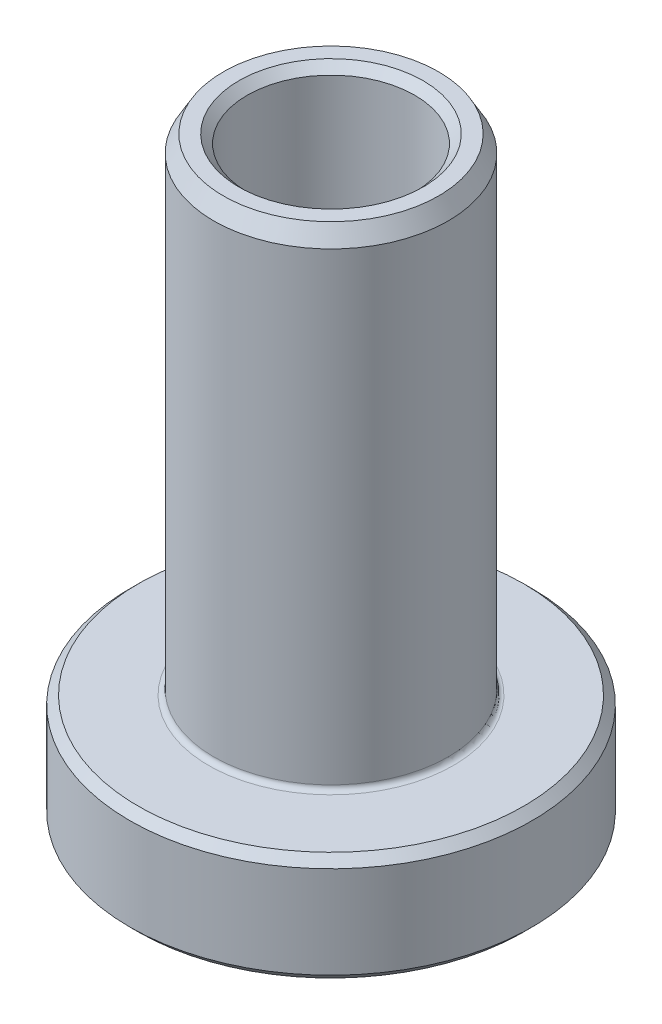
SolidWorks part; units mm, degrees
ref_plane "Plan1" through (0, 0, 0) normal (0, 0, 1) x (1, 0, 0)
ref_plane "Plan2" through (0, 0, 0) normal (0, 1, 0) x (1, 0, 0)
ref_plane "Plan3" through (0, 0, 0) normal (1, 0, 0) x (0, 0, -1)
sketch "Esquisse1" plane through (0, 0, 0) normal (0, 0, 1) x (1, 0, 0)
  line L0 (0, 48.516) -> (0, -4.0839) construction
  line L1 (5, 0) -> (12, 0)
  line L2 (12, 0) -> (12, 6.5)
  line L3 (12, 6.5) -> (7, 6.5)
  line L4 (7, 6.5) -> (7, 35.5)
  line L5 (7, 35.5) -> (5, 35.5)
  line L6 (5, 35.5) -> (5, 0)
  dimension "D1" = 5
  dimension "D2" = 12
  dimension "D3" = 7
  dimension "D4" = 6.5
  dimension "D5" = 35.5
revolve "Base-Révolution" add sketch "Esquisse1" angle 360 about L0
fillet "Congé1" radius 0.3
chamfer "Chanfrein1" distance 1 angle 30
chamfer "Chanfrein2" distance 0.5 angle 45
